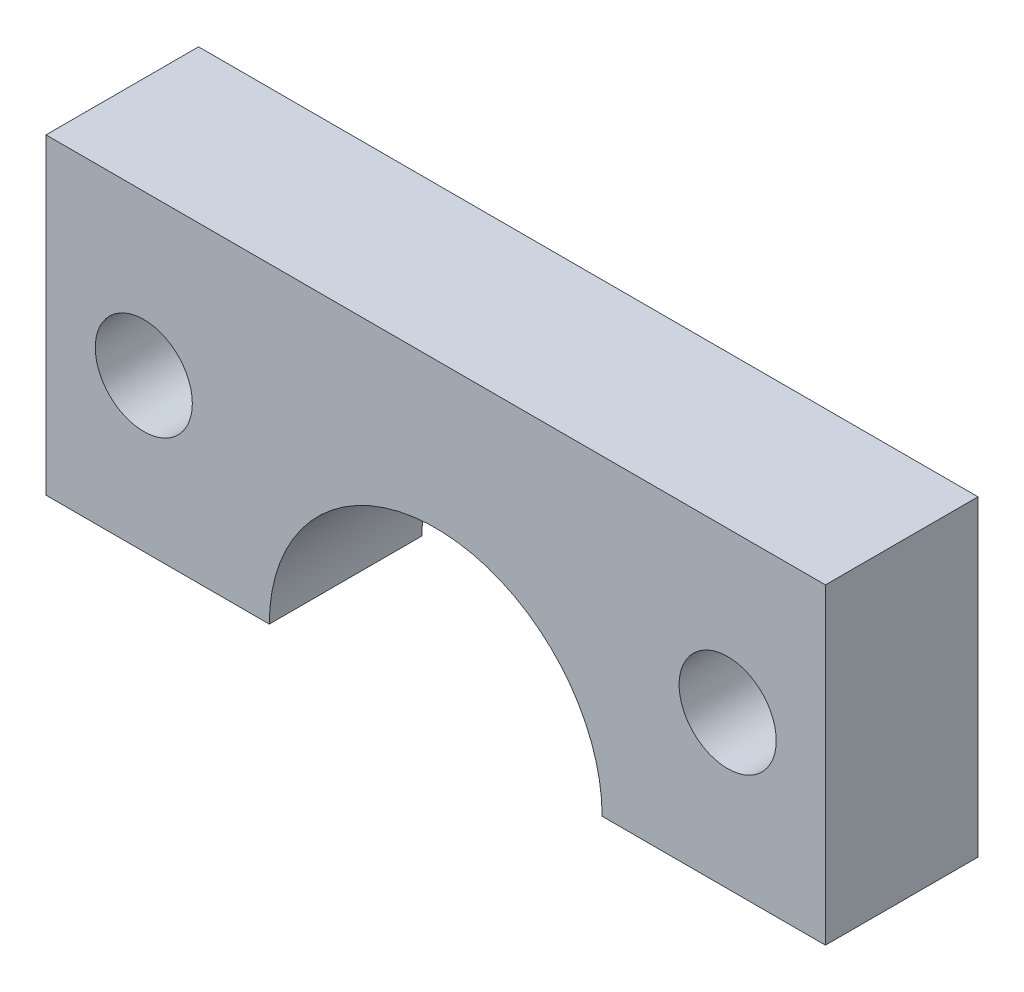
SolidWorks part; units mm, degrees
ref_plane "Front Plane" through (0, 0, 0) normal (0, 0, 1) x (1, 0, 0)
ref_plane "Top Plane" through (0, 0, 0) normal (0, 1, 0) x (1, 0, 0)
ref_plane "Right Plane" through (0, 0, 0) normal (1, 0, 0) x (0, 0, -1)
sketch "Sketch1" plane through (0, 0, 0) normal (0, 0, 1) x (1, 0, 0)
  line L0 (-22.6, 16.75) -> (-14.55, 16.75)
  line L2 (-17.1, 5.5) -> (-11.3, 5.5) construction
  line L4 (-2.55, 16.75) -> (5.5, 16.75)
  line L7 (-19.85, 5.5) -> (-22.6, 5.5) construction
  line L8 (-22.6, 5.5) -> (-22.6, 28) construction
  line L9 (-22.6, 28) -> (5.5, 28) construction
  line L10 (0, 5.5) -> (-5.8, 5.5) construction
  line L11 (5.5, 28) -> (5.5, 5.5) construction
  line L12 (5.5, 5.5) -> (2.75, 5.5) construction
  line L13 (-19.85, 16.75) -> (-19.85, 28) construction
  line L14 (-19.85, 28) -> (2.75, 28) construction
  line L15 (2.75, 28) -> (2.75, 16.75) construction
  line L17 (2.75, 28) -> (-8.55, 16.75) construction
  line L32 (-19.85, 28) -> (2.75, 28)
  line L34 (-19.85, 28) -> (-22.6, 28)
  line L35 (-22.6, 28) -> (-22.6, 16.75)
  line L36 (1.975, 16.75) -> (1.975, 22.25) construction
  line L37 (2.75, 28) -> (5.5, 28)
  line L38 (5.5, 28) -> (5.5, 16.75)
  line L39 (-19.075, 16.75) -> (-19.075, 22.25) construction
  line L41 (-8.55, 16.75) -> (-19.85, 28) construction
  line L42 (-5.8, 5.5) -> (0, 5.5) construction
  line L43 (-11.3, 5.5) -> (-17.1, 5.5) construction
  circle A2 centre (1.975, 22.25) radius 1.75
  circle A3 centre (-19.075, 22.25) radius 1.75
  arc A5 (-2.55, 16.75) -> (-14.55, 16.75) centre (-8.55, 16.75) ccw
  point P8 (-8.55, 5.5)
  point P17 (-8.55, 5.5)
  point P21 (0, 0)
  dimension "D1" = 17.1
  dimension "D2" = 22.5
  dimension "D4" = 12
  dimension "D3" = 28.1
extrude "Boss-Extrude2" add sketch "Sketch1" along normal blind 5.5
